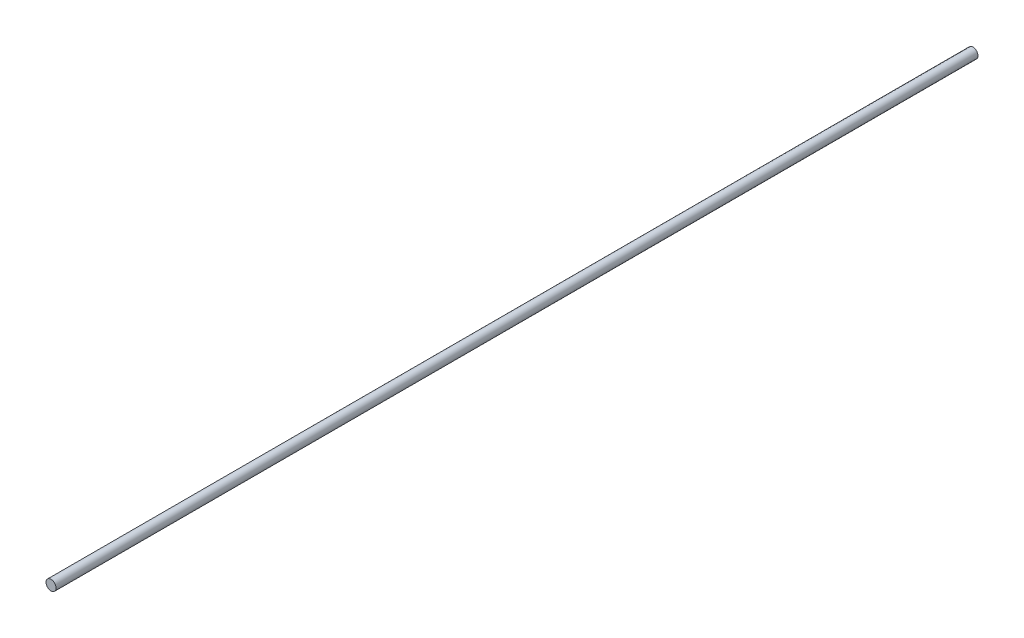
SolidWorks part; units mm, degrees
ref_plane "Front Plane" through (0, 0, 0) normal (0, 0, 1) x (1, 0, 0)
ref_plane "Top Plane" through (0, 0, 0) normal (0, 1, 0) x (1, 0, 0)
ref_plane "Right Plane" through (0, 0, 0) normal (1, 0, 0) x (0, 0, -1)
sketch "Sketch1" plane through (0, 0, 0) normal (0, 0, 1) x (1, 0, 0)
  circle A0 centre (0, 0) radius 30
  dimension "D1" = 60
extrude "Boss-Extrude1" add sketch "Sketch1" against normal blind 5500
